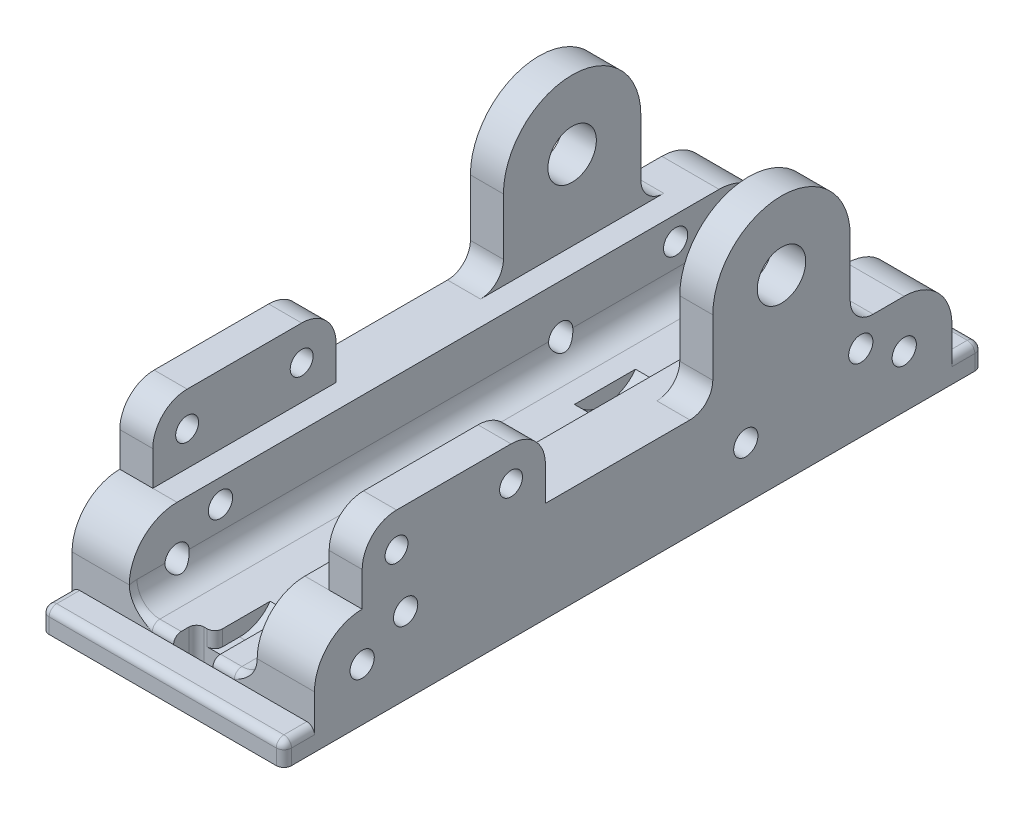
SolidWorks part; units mm, degrees
ref_plane "Front Plane" through (0, 0, 0) normal (0, 0, 1) x (1, 0, 0)
ref_plane "Top Plane" through (0, 0, 0) normal (0, 1, 0) x (1, 0, 0)
ref_plane "Right Plane" through (0, 0, 0) normal (1, 0, 0) x (0, 0, -1)
sketch "values-params_print" plane through (0, 0, 0) normal (0, 0, 1) x (1, 0, 0)
  line L0 (0, 0) -> (0.7, 0) construction
  line L1 (0, -5.2349) -> (3, -5.2349) construction
  line L2 (0, -10.104) -> (4, -10.104) construction
  line L4 (0, -19.837) -> (0.15, -19.837) construction
  line L5 (0, -24.2596) -> (0.35, -24.2596) construction
  line L6 (0, -28.606) -> (3.175, -28.606) construction
  line L7 (0, -33.0286) -> (9.5, -33.0286) construction
  line L8 (0, -37.6038) -> (2.4, -37.6038) construction
  line L9 (0, -43.1661) -> (6.35, -43.1661) construction
  dimension "width destroy" = 0.7
  dimension "width keep" = 3
  dimension "width tab" = 4
  dimension "print fit" = 0.15
  dimension "print free" = 0.35
  dimension "pin diameter" = 3.175
  dimension "pulley diameter" = 9.5
  dimension "pulley thickness" = 2.4
  dimension "base pin diameter" = 6.35
inserted part "params_print"
sketch "values-params_finger_t42" plane through (0, 0, 0) normal (0, 0, 1) x (1, 0, 0)
  line L0 (0, 0) -> (62.5, 0) construction
  line L1 (0, -4.9462) -> (37.5, -4.9462) construction
  line L2 (0, -9.7143) -> (2.8, -9.7143) construction
  line L3 (0, -13.496) -> (3.8002, -13.496) construction
  line L4 (0, -17.4421) -> (10, -17.4421) construction
  line L5 (0, -21.6348) -> (10, -21.6348) construction
  line L6 (0, -25.663) -> (8, -25.663) construction
  line L7 (0, -29.4447) -> (8, -29.4447) construction
  line L8 (0, -32.88) -> (18, -32.88) construction
  line L9 (0, -36.2915) -> (31.75, -36.2915) construction
  line L10 (0, -39.8857) -> (77.5, -39.8857) construction
  line L11 (0, -43.8499) -> (60, -43.8499) construction
  line L12 (0, -47.895) -> (4.5, -47.895) construction
  line L13 (0, -51.6975) -> (15, -51.6975) construction
  line L14 (0, -55.9037) -> (15, -55.9037) construction
  line L15 (0, -61.7021) -> (44.45, -61.7021) construction
  dimension "Lp" = 62.5
  dimension "Ld" = 37.5
  dimension "Kp" = 2.8
  dimension "Kd" = 3.8002
  dimension "Kp Length" = 10
  dimension "Kd Length" = 10
  dimension "Rp" = 8
  dimension "Rd" = 8
  dimension "height" = 18
  dimension "depth" = 31.75
  dimension "Lb" = 77.5
  dimension "Lb Pivot" = 60
  dimension "pad thickness" = 4.5
  dimension "Tp" = 15
  dimension "Td" = 15
  dimension "base depth" = 44.45
inserted part "params_finger_t42"
sketch "Sketch3" plane through (0, 0, 0) normal (1, 0, 0) x (0, 0, -1)
  line L0 (-4.675, -16.675) -> (4.675, -16.675) construction
  line L1 (0, 0) -> (0, -16.675) construction
  line L2 (-4.675, -19.85) -> (4.675, -19.85) construction
  line L3 (-9, 0) -> (-9, -10.425)
  line L4 (-4.675, -9) -> (0, -9) construction
  line L5 (-54.925, -10.425) -> (-50.425, -10.425) construction
  line L6 (-61.175, -16.675) -> (-61.175, -23.55)
  line L7 (-61.175, -23.55) -> (22.325, -23.55)
  line L8 (22.325, -16.675) -> (22.325, -23.55)
  line L9 (9, 0) -> (9, -10.425)
  line L10 (9, -10.425) -> (16.075, -10.425)
  line L11 (-54.925, -5.925) -> (-54.925, -10.425)
  line L12 (-30.925, -5.925) -> (-30.925, -10.425)
  line L13 (-50.425, -5.925) -> (-35.425, -5.925) construction
  line L14 (-30.925, -10.425) -> (-9, -10.425)
  line L15 (-50.425, -1.425) -> (-35.425, -1.425)
  line L16 (4.675, -16.675) -> (16.075, -16.675) construction
  line L17 (10.375, -16.675) -> (10.375, -15.0125) construction
  circle A0 centre (0, 0) radius 3.175
  arc A1 (-9, 0) -> (9, 0) centre (0, 0) cw
  circle A2 centre (-4.675, -16.675) radius 3.175 construction
  circle A3 centre (4.675, -16.675) radius 3.175 construction
  circle A4 centre (0, 0) radius 9 construction
  circle A5 centre (-4.675, -16.675) radius 7.675 construction
  circle A6 centre (10.375, -15.0125) radius 1.5875 construction
  circle A7 centre (-54.925, -16.675) radius 3.175 construction
  circle A8 centre (16.075, -16.675) radius 3.175 construction
  circle A9 centre (-4.675, -16.675) radius 8.375 construction
  arc A10 (-61.175, -16.675) -> (-54.925, -10.425) centre (-54.925, -16.675) cw
  arc A11 (16.075, -10.425) -> (22.325, -16.675) centre (16.075, -16.675) cw
  circle A12 centre (-50.425, -5.925) radius 1.5
  circle A13 centre (-35.425, -5.925) radius 1.5
  arc A14 (-54.925, -5.925) -> (-50.425, -1.425) centre (-50.425, -5.925) cw
  circle A15 centre (-50.425, -5.925) radius 4.5 construction
  arc A16 (-30.925, -5.925) -> (-35.425, -1.425) centre (-35.425, -5.925) ccw
  circle A17 centre (-54.925, -16.675) radius 1.5875
  circle A18 centre (-4.675, -16.675) radius 1.5875
  circle A19 centre (4.675, -16.675) radius 1.5875 construction
  circle A20 centre (16.075, -16.675) radius 1.5875
  circle A21 centre (-4.675, -16.675) radius 6.875 construction
  circle A22 centre (-54.925, -16.675) radius 4.75 construction
  circle A23 centre (16.075, -16.675) radius 4.75 construction
  point P21 (20.825, -16.675)
  point P32 (10.375, -13.425)
  point P53 (-19.425, -23.55)
  point P54 (-59.675, -16.675)
  dimension "D1" = 6.35
  dimension "D2" = 18
  dimension "D5" = 4.5
  dimension "D6" = 3.175
  dimension "D3" = 5.2
  dimension "D11" = 3
  dimension "D13" = 3
  dimension "D8" = 3.175
  dimension "D14" = 3.7
  dimension "D16" = 9.5
  dimension "D4" = 9.35
  dimension "D7" = 80.5
  dimension "D9" = 19.425
  dimension "D10" = 3
  dimension "D12" = 15
  dimension "D15" = 1.5
extrude "Main Body" add sketch "Sketch3" along normal mid plane 31.75
sketch "Sketch16" plane through (15.875, 0, 0) normal (1, 0, 0) x (0, 0, -1)
  line L0 (-19.425, -23.55) -> (-19.425, -1.6608) construction
  line L1 (-61.175, -23.55) -> (-65.175, -23.55)
  line L2 (-61.175, -23.55) -> (-61.175, -20.55)
  line L3 (-61.175, -20.55) -> (-65.175, -20.55)
  line L4 (-65.175, -23.55) -> (-65.175, -20.55)
  line L5 (-61.175, -23.55) -> (22.325, -23.55) construction
  line L6 (22.325, -23.55) -> (22.325, -20.55)
  line L7 (22.325, -23.55) -> (26.325, -23.55)
  line L8 (26.325, -23.55) -> (26.325, -20.55)
  line L9 (22.325, -20.55) -> (26.325, -20.55)
  dimension "D1" = 4
  dimension "D2" = 3
extrude "Base Tabs" add sketch "Sketch16" against normal up to surface (31.75 mm away)
sketch "Sketch5" plane through (0, 0, -22.325) normal (0, 0, -1) x (-1, 0, 0)
  line L0 (0, -23.55) -> (0, 20.0099) construction
  line L2 (-15.875, 9) -> (-15.875, 0) construction
  line L3 (-15.875, 9) -> (-15.875, 0) construction
  line L5 (-8.375, -23.55) -> (8.375, -23.55)
  line L6 (-8.375, -23.55) -> (-8.375, 9)
  line L7 (-8.375, 9) -> (8.375, 9)
  line L8 (8.375, -23.55) -> (8.375, 9)
  line L9 (15.875, -23.55) -> (-15.875, -23.55) construction
  line L10 (15.875, -23.55) -> (-15.875, -23.55) construction
  dimension "D1" = 16.75
extrude "Clearance - Middle" cut sketch "Sketch5" against normal up to surface (83.5 mm away)
sketch "Sketch17" plane through (0, -23.55, 0) normal (0, -1, 0) x (1, 0, 0)
  line L1 (-8.375, 61.175) -> (-8.375, -22.325) construction
  line L2 (8.375, 61.175) -> (8.375, -22.325) construction
  line L3 (-8.375, 61.175) -> (-8.375, -22.325)
  line L4 (8.375, 61.175) -> (8.375, -22.325)
  line L5 (0, 0) -> (0, 36.5878) construction
  line L6 (-8.375, 61.175) -> (-2.575, 61.175)
  line L7 (-8.375, 61.175) -> (8.375, 61.175) construction
  line L8 (-2.575, 61.175) -> (-2.575, 58.175)
  line L9 (-2.575, 58.175) -> (2.575, 58.175)
  line L10 (2.575, 58.175) -> (2.575, 61.175)
  line L11 (2.575, 61.175) -> (8.375, 61.175)
  line L12 (-8.375, 19.425) -> (8.375, 19.425) construction
  line L13 (2.575, -22.325) -> (8.375, -22.325)
  line L14 (2.575, -19.325) -> (2.575, -22.325)
  line L15 (-2.575, -19.325) -> (2.575, -19.325)
  line L16 (-2.575, -22.325) -> (-2.575, -19.325)
  line L17 (-8.375, -22.325) -> (-2.575, -22.325)
  dimension "D1" = 3
  dimension "D2" = 5.15
extrude "Base Bottom" add sketch "Sketch17" against normal blind 4
sketch "Sketch7" plane through (0, 0, -9) normal (0, 0, -1) x (-1, 0, 0)
  line L0 (-15.875, -10.425) -> (-8.375, -10.425) construction
  line L1 (-11.55, -10.425) -> (11.55, -10.425)
  line L2 (-11.55, -10.425) -> (-11.55, 9)
  line L3 (-11.55, 9) -> (11.55, 9)
  line L4 (11.55, -10.425) -> (11.55, 9)
  line L5 (0, 0) -> (0, 9) construction
  line L6 (-15.875, 9) -> (-15.875, 0) construction
  line L7 (-15.875, 9) -> (-15.875, 0) construction
  dimension "D1" = 4.325
extrude "Print Clearance - Finger" cut sketch "Sketch7" against normal through all
sketch "Sketch8" plane through (0, 0, 0) normal (1, 0, 0) x (0, 0, -1)
  line L2 (21, -16.675) -> (21, -21.6)
  line L3 (21, -21.6) -> (16.075, -21.6)
  line L4 (-54.925, -21.6) -> (-59.85, -21.6)
  line L5 (-59.85, -16.675) -> (-59.85, -21.6)
  circle A0 centre (-54.925, -16.675) radius 1.5875 construction
  circle A1 centre (-4.675, -16.675) radius 1.5875 construction
  circle A3 centre (16.075, -16.675) radius 1.5875 construction
  circle A4 centre (-54.925, -16.675) radius 1.5875 construction
  circle A5 centre (-4.675, -16.675) radius 1.5875 construction
  circle A7 centre (16.075, -16.675) radius 1.5875 construction
  arc A8 (-54.925, -21.6) -> (-59.85, -16.675) centre (-54.925, -16.675) ccw
  circle A9 centre (-4.675, -16.675) radius 4.925
  arc A11 (21, -16.675) -> (16.075, -21.6) centre (16.075, -16.675) ccw
  dimension "D1" = 9.85
extrude "Clearance - Pulleys" cut sketch "Sketch8" against normal up to surface and the other way up to surface
sketch "Sketch9" plane through (-2.575, 0, 0) normal (1, 0, 0) x (0, 0, -1)
  line L0 (-54.925, -21.6) -> (-58.175, -21.6) construction
  line L1 (-54.925, -21.6) -> (-58.175, -21.6)
  line L2 (-58.175, -21.6) -> (-58.175, -19.55)
  line L3 (-50.9263, -19.55) -> (-61.175, -19.55) construction
  line L4 (-58.175, -19.55) -> (-50.9263, -19.55)
  arc A0 (-54.925, -21.6) -> (-50.9263, -19.55) centre (-54.925, -16.675) ccw construction
  arc A1 (-54.925, -21.6) -> (-50.9263, -19.55) centre (-54.925, -16.675) ccw
extrude "Block - Pulley 1" add sketch "Sketch9" along normal offset from surface (2.4 mm away) 2.75
sketch "Sketch10" plane through (2.575, 0, 0) normal (-1, 0, 0) x (0, 0, 1)
  line L0 (-19.325, -21.6) -> (-16.075, -21.6) construction
  line L1 (-19.325, -21.6) -> (-16.075, -21.6)
  line L2 (-19.325, -21.6) -> (-19.325, -19.55)
  line L3 (-12.0763, -19.55) -> (-22.325, -19.55) construction
  line L4 (-19.325, -19.55) -> (-12.0763, -19.55)
  arc A0 (-16.075, -21.6) -> (-12.0763, -19.55) centre (-16.075, -16.675) ccw construction
  arc A1 (-16.075, -21.6) -> (-12.0763, -19.55) centre (-16.075, -16.675) ccw
extrude "Block - Pulley 2" add sketch "Sketch10" along normal offset from surface (2.4 mm away) 2.75
sketch "Sketch15" plane through (15.875, 0, 0) normal (1, 0, 0) x (0, 0, -1)
  line L0 (16.075, -10.425) -> (9, -10.425) construction
  circle A0 centre (0, 0) radius 9 construction
  arc A1 (9, 0) -> (-9, 0) centre (0, 0) ccw construction
  circle A3 centre (-54.925, -16.675) radius 4.925 construction
  circle A7 centre (16.075, -16.675) radius 4.925 construction
  circle A8 centre (10.3819, -13.5125) radius 1.5875
  circle A9 centre (-49.2319, -13.5125) radius 1.5875
  point P13 (10.3819, -11.925)
  dimension "D1" = 3.175
  dimension "D3" = 9.85
  dimension "D4" = 1.5
extrude "Clearance - Tendon Trap Pins" cut sketch "Sketch15" against normal through all
fillet "Contouring" radius 1 18 edges at (-2.575, -21.55, 58.175) (-0.175, -20.575, 58.175) (5.475, -19.55, 61.175) (-5.475, -19.55, 61.175) (15.875, -22.05, 65.175) (15.875, -20.55, 63.175) (0, -20.55, 65.175) (-15.875, -22.05, 65.175) (-15.875, -20.55, 63.175) (2.575, -21.55, -19.325) (0.175, -20.575, -19.325) (5.475, -19.55, -22.325) (-5.475, -19.55, -22.325) (-15.875, -22.05, -26.325) (-15.875, -20.55, -24.325) (0, -20.55, -26.325) (15.875, -22.05, -26.325) (15.875, -20.55, -24.325)
fillet "Inner Contouring" radius 3 6 edges at (8.375, -19.8429, -22.0321) (8.375, -19.8429, 60.8821) (-8.375, -19.8429, 60.8821) (-8.375, -19.8429, -22.0321) (8.375, -19.55, 19.425) (-8.375, -19.55, 19.425)
fillet "Outer Contouring" radius 3 2 edges at (-13.7125, -10.425, -9) (-13.7125, -10.425, 9)
ref_point "Point1"
equation "\"D1@Sketch3\"=\"base pin diameter@values@params_print.SLDPRT\""
equation "\"D2@Sketch3\"  = \"height@values@params_finger_t42.SLDPRT\""
equation "\"D3@Sketch3\"=\"D5@Sketch3\"+\"width destroy@values@params_print.SLDPRT\""
equation "\"D4@Sketch3\"=\"base pin diameter@values@params_print.SLDPRT\"+\"width keep@values@params_print.SLDPRT\""
equation "\"D5@Sketch3\"=\"width keep@values@params_print.SLDPRT\"*1.5"
equation "\"D6@Sketch3\"=\"pin diameter@values@params_print.SLDPRT\""
equation "\"D1@Main Body\"  = \"depth@values@params_finger_t42.SLDPRT\""
equation "\"D10@Sketch3\"=\"width keep@values@params_print.SLDPRT\""
equation "\"D1@Sketch5\"=\"depth@values@params_finger_t42.SLDPRT\" - 5 * \"width keep@values@params_print.SLDPRT\""
equation "\"D13@Sketch3\"=\"width keep@values@params_print.SLDPRT\""
equation "\"D8@Sketch3\"=\"pin diameter@values@params_print.SLDPRT\""
equation "\"D1@Sketch8\" = \"pulley diameter@values@params_print.SLDPRT\" + \"print free@values@params_print.SLDPRT\""
equation "\"D1@Sketch15\"=\"pin diameter@values@params_print.SLDPRT\""
equation "\"D3@Sketch15\" = \"pulley diameter@values@params_print.SLDPRT\" + \"print free@values@params_print.SLDPRT\""
equation "\"D14@Sketch3\"=\"width keep@values@params_print.SLDPRT\"+\"width destroy@values@params_print.SLDPRT\""
equation "\"D16@Sketch3\"=\"pulley diameter@values@params_print.SLDPRT\""
equation "\"D15@Sketch3\"=\"width keep@values@params_print.SLDPRT\"/2"
equation "\"D1@Sketch16\"=\"width tab@values@params_print.SLDPRT\""
equation "\"D2@Sketch16\"=\"width keep@values@params_print.SLDPRT\""
equation "\"D1@Sketch17\"=\"width keep@values@params_print.SLDPRT\""
equation "\"D2@Sketch17\"=\"pulley thickness@values@params_print.SLDPRT\"*2+\"print free@values@params_print.SLDPRT\""
equation "\"D1@Sketch7\"=1.5*\"width keep@values@params_print.SLDPRT\"-\"print free@values@params_print.SLDPRT\"/2"
equation "\"D1@Block - Pulley 1\"=\"pulley thickness@values@params_print.SLDPRT\"+\"print free@values@params_print.SLDPRT\""
equation "\"D1@Block - Pulley 2\"=\"pulley thickness@values@params_print.SLDPRT\"+\"print free@values@params_print.SLDPRT\""
